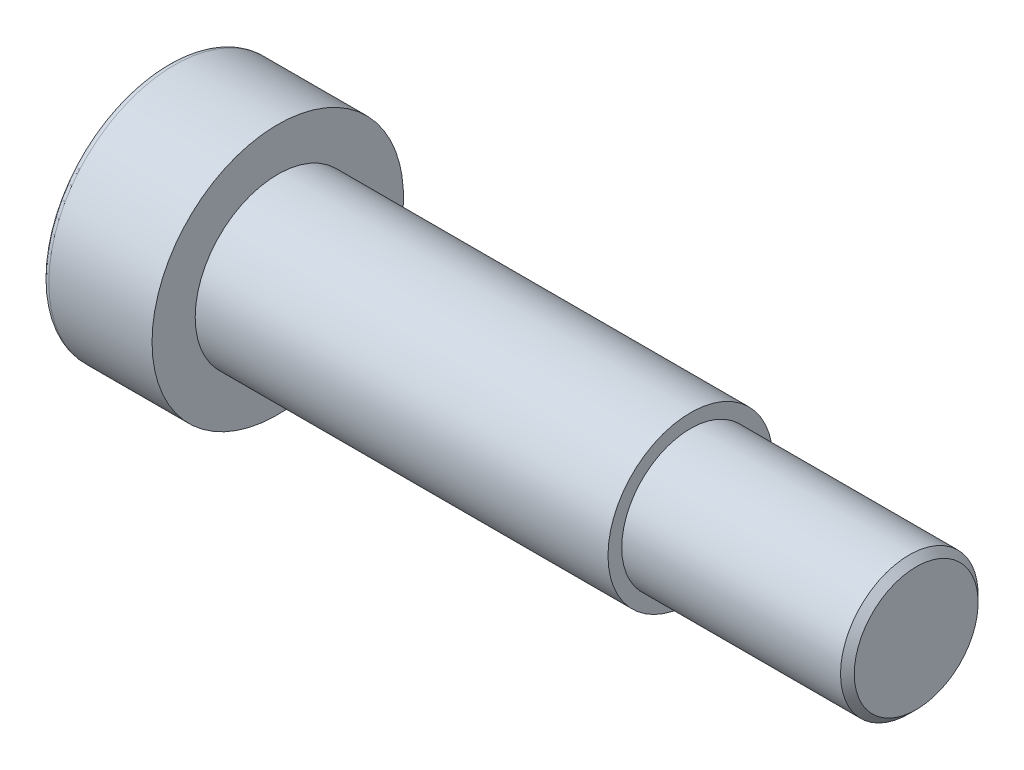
SolidWorks part; units mm, degrees
ref_plane "Face" through (0, 0, 0) normal (0, 0, 1) x (1, 0, 0)
ref_plane "Dessus" through (0, 0, 0) normal (0, 1, 0) x (1, 0, 0)
ref_plane "Droite" through (0, 0, 0) normal (1, 0, 0) x (0, 0, -1)
sketch "Esquisse1" plane through (0, 0, 0) normal (0, 0, 1) x (1, 0, 0)
  line L0 (0, 0) -> (0, 9.135)
  line L1 (0, 9.135) -> (8, 9.135)
  line L2 (8, 9.135) -> (8, 6)
  line L3 (8, 6) -> (38, 6)
  line L4 (38, 6) -> (38, 5)
  line L5 (38, 5) -> (54.4, 5)
  line L6 (54.4, 5) -> (54.4, 0)
  line L7 (54.4, 0) -> (0, 0)
  line L8 (-16.7791, 0) -> (105.3877, 0) construction
  dimension "D1" = 30
  dimension "D2" = 16.4
  dimension "D3" = 8
  dimension "D4" = 10
  dimension "D5" = 12
  dimension "D6" = 18.27
revolve "Base-Révolution" add sketch "Esquisse1"
chamfer "Chanfrein1" distance 0.5 angle 45 1 edges at (54.4, 0, 5)
fillet "Congé1" radius 0.5 1 edges at (0, 0, 9.135)
sketch "Esquisse2" plane through (0, 0, 0) normal (-1, 0, 0) x (0, 0, 1)
  line L0 (-1.7321, 3) -> (1.7321, 3)
  line L1 (-1.7321, -3) -> (1.7321, -3)
  line L2 (1.7321, 3) -> (3.4641, 0)
  line L3 (3.4641, 0) -> (1.7321, -3)
  line L4 (-1.7321, 3) -> (-3.4641, 0)
  line L5 (-3.4641, 0) -> (-1.7321, -3)
  circle A0 centre (0, 0) radius 3 construction
  dimension "D3" = 6
  dimension "D1" = 120
  dimension "D2" = 120
extrude "Enlèv. mat.-Extru.1" cut sketch "Esquisse2" against normal blind 5
